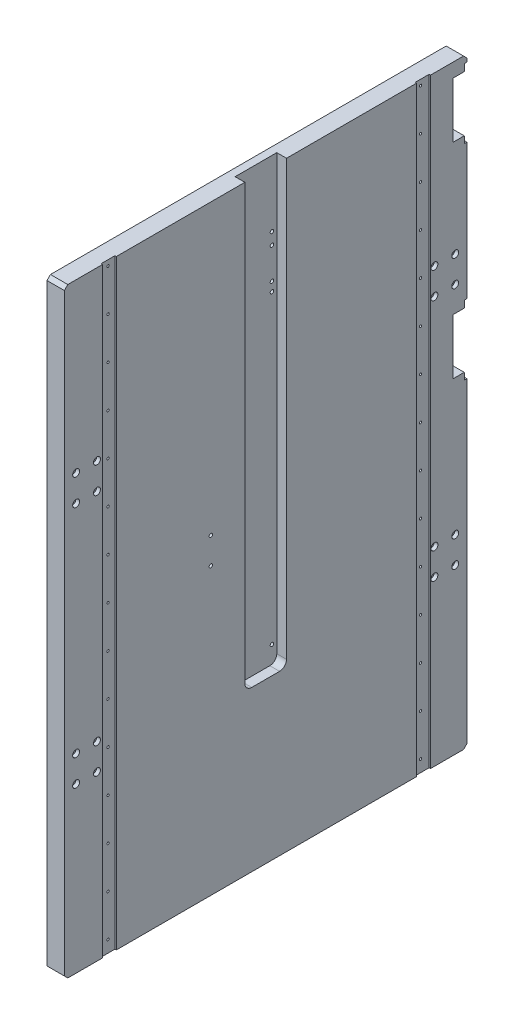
SolidWorks part; units mm, degrees
ref_plane "Plan1" through (0, 0, 0) normal (0, 0, 1) x (1, 0, 0)
ref_plane "Plan2" through (0, 0, 0) normal (0, 1, 0) x (1, 0, 0)
ref_plane "Plan3" through (0, 0, 0) normal (1, 0, 0) x (0, 0, -1)
sketch "Esquisse1" plane through (0, 0, 0) normal (1, 0, 0) x (0, 0, -1)
  line L0 (0, 989.0525) -> (0, -18.7031) construction
  line L1 (0, 13.75) -> (0, -13.75) construction
  line L4 (-290, 530) -> (-290, -335)
  line L5 (-290, -335) -> (290, -335)
  line L6 (290, 530) -> (290, -335)
  line L7 (13.75, 0) -> (-13.75, 0) construction
  line L15 (-290, 530) -> (290, 530)
  dimension "D2" = 580
  dimension "D3" = 335
  dimension "D4" = 530
extrude "Boss.-Extru.1" add sketch "Esquisse1" against normal blind 25
sketch "Esquisse2" plane through (0, 0, 0) normal (1, 0, 0) x (0, 0, -1)
  line L0 (0, 890.1135) -> (0, 354.2428) construction
  line L2 (-30, 530) -> (-30, -95)
  line L4 (30, 530) -> (30, -95)
  line L5 (0, 13.75) -> (0, -13.75) construction
  line L7 (290, 530) -> (-290, 530) construction
  line L12 (-20, -105) -> (20, -105)
  line L24 (-30, 530) -> (30, 530)
  arc A6 (30, -95) -> (20, -105) centre (20, -95) cw
  arc A7 (-20, -105) -> (-30, -95) centre (-20, -95) cw
  dimension "D3" = 635
  dimension "D2" = 10
  dimension "D1" = 60
extrude "Enlèv. mat.-Extru.1" cut sketch "Esquisse2" against normal blind 14
hole_wizard "Trou taraudé M61" positions "Esquisse3" profile "Esquisse4" tap size "M6" standard "ISO"
sketch "Esquisse3" plane through (-14, 0, 0) normal (1, 0, 0) x (0, 0, -1)
  line L0 (0, 558.3188) -> (0, 340.3466) construction
  line L2 (0, 13.75) -> (0, -13.75) construction
  line L7 (290, 530) -> (30, 530) construction
  point P0 (-23, 373)
  point P2 (-23, 360)
  point P13 (23, 360)
  point P14 (23, 373)
  point P21 (-23, 418)
  point P23 (-23, 435)
  point P28 (23, 435)
  point P29 (23, 418)
  point P32 (-23, -80)
  point P34 (23, -80)
  dimension "D1" = 46
  dimension "D2" = 13
  dimension "D3" = 170
  dimension "D4" = 58
  dimension "D5" = 17
  dimension "D6" = 440
sketch "Esquisse4" plane through (-14, 373, 23) normal (0, 1, 0) x (0, 0, -1)
  line L0 (0, 0) -> (0, 11)
  line L1 (0, 11) -> (2.5, 11)
  line L2 (2.5, 11) -> (2.5, 0)
  line L5 (2.5, 0) -> (0, 0)
  line L11 (0, -6.35) -> (0, 107.95) construction
  dimension "Diamètre du trou pour taraudage jusqu'au prochain" = 5
  dimension "Profondeur du trou pour taraudage jusqu'au prochain" = 11
sketch "Esquisse17" plane through (0, 0, 0) normal (-1, 0, 0) x (0, 0, 1)
  line L1 (-237.5, 530) -> (-217.5, 530)
  line L2 (-237.5, 530) -> (-237.5, -335)
  line L3 (-237.5, -335) -> (-217.5, -335)
  line L4 (-217.5, 530) -> (-217.5, -335)
  line L5 (215, 530) -> (235, 530)
  line L6 (215, 530) -> (215, -335)
  line L7 (215, -335) -> (235, -335)
  line L8 (235, 530) -> (235, -335)
  line L9 (290, -335) -> (-290, -335) construction
  line L10 (-225, -146.0818) -> (-225, 642.6306) construction
  line L11 (0, -13.75) -> (0, 13.75) construction
  line L12 (0, 662.781) -> (0, -107.936) construction
  line L13 (-290, 530) -> (-30, 530) construction
  line L14 (225, -75.7623) -> (225, 642.6306) construction
  line L15 (30, 530) -> (290, 530) construction
  dimension "D1" = 7.5
  dimension "D2" = 450
  dimension "D3" = 20
  dimension "D4" = 20
extrude "Enlèv. mat.-Extru.6" cut sketch "Esquisse17" along normal blind 2
hole_wizard "Chambrage pour vis à tête hexagonale M51" positions "Esquisse22" profile "Esquisse23" counterbore size "M5" standard "ISO"
sketch "Esquisse22" plane through (0, 0, 0) normal (1, 0, 0) x (0, 0, -1)
  line L0 (254.4012, 270) -> (-290.5094, 270) construction
  line L2 (258, 307.742) -> (258, 237.6102) construction
  line L4 (13.75, 0) -> (-13.75, 0) construction
  line L5 (0, 13.75) -> (0, -13.75) construction
  line L7 (290, 251) -> (273, 251)
  line L8 (273, 251) -> (243, 251)
  line L10 (-243, 251) -> (-273, 251)
  line L11 (-273, 251) -> (-290, 251)
  line L12 (-290, 530) -> (-290, -335) construction
  line L13 (290, -335) -> (290, 530) construction
  point P15 (273, 289)
  point P17 (273, 251)
  point P19 (243, 251)
  point P21 (243, 289)
  point P27 (-243, 251)
  point P29 (-273, 251)
  point P31 (-273, 289)
  point P33 (-243, 289)
  dimension "D1" = 270
  dimension "D2" = 258
  dimension "D3" = 38
  dimension "D4" = 30
  dimension "D6" = 516
sketch "Esquisse23" plane through (0, 289, 243) normal (0, 1, 0) x (0, 0, -1)
  line L0 (0, 0) -> (0, 25)
  line L1 (0, 25) -> (2.75, 25)
  line L3 (2.75, 25) -> (2.75, 5.4)
  line L4 (2.75, 5.4) -> (5, 5.4)
  line L5 (5, 5.4) -> (5, 0)
  line L7 (5, 0) -> (0, 0)
  line L11 (0, -6.35) -> (0, 107.95) construction
  dimension "Diamètre du perçage jusqu'au prochain" = 5.5
  dimension "Profondeur du perçage jusqu'au prochain" = 25
  dimension "Diamètre du chambrage" = 10
  dimension "Profondeur du chambrage" = 5.4
pattern_linear "Répétition linéaire1" count 2 spacing 350 along (0, -1, 0) of "Chambrage pour vis à tête hexagonale M51"
hole_wizard "Trou taraudé M44" positions "Esquisse26" profile "Esquisse27" tap size "M4" standard "ISO"
sketch "Esquisse26" plane through (-2, 0, 0) normal (1, 0, 0) x (0, 0, -1)
  line L0 (-225, -75.7623) -> (-225, 642.6306) construction
  line L1 (225, -146.0818) -> (225, 642.6306) construction
  line L2 (237.5, 530) -> (217.5, 530) construction
  point P0 (225, 522)
  point P2 (-225, 522)
  dimension "D1" = 8
sketch "Esquisse27" plane through (-2, 522, -225) normal (0, 1, 0) x (0, 0, -1)
  line L0 (0, 0) -> (0, 11.0914)
  line L1 (0, 11.0914) -> (1.65, 10.1)
  line L2 (1.65, 10.1) -> (1.65, 0)
  line L5 (1.65, 0) -> (0, 0)
  line L10 (0, 11.0914) -> (-1.65, 10.1) construction
  line L11 (0, -6.35) -> (0, 107.95) construction
  dimension "Diamètre du trou pour taraudage" = 3.3
  dimension "Profondeur du trou pour taraudage" = 10.1
  dimension "Angle de pointe" = 118
pattern_linear "Répétition linéaire2" count 15 spacing 60 along (0, -1, 0) of "Trou taraudé M44"
hole_wizard "Trou taraudé M62" positions "Esquisse30" profile "Esquisse31" tap size "M6" standard "ISO"
sketch "Esquisse30" plane through (-25, 0, 0) normal (-1, 0, 0) x (0, 0, 1)
  line L0 (-313.3363, 95) -> (312.2973, 95) construction
  line L2 (13.75, 0) -> (-13.75, 0) construction
  line L3 (0, -13.75) -> (0, 13.75) construction
  point P5 (21, 76)
  point P7 (79, 76)
  point P9 (79, 114)
  point P10 (21, 114)
  dimension "D1" = 95
  dimension "D2" = 58
  dimension "D3" = 38
  dimension "D4" = 79
sketch "Esquisse31" plane through (-25, 114, 21) normal (0, 1, 0) x (0, 0, 1)
  line L0 (0, 0) -> (0, 25)
  line L1 (0, 25) -> (2.5, 25)
  line L2 (2.5, 25) -> (2.5, 0)
  line L5 (2.5, 0) -> (0, 0)
  line L11 (0, -6.35) -> (0, 107.95) construction
  dimension "Diamètre du trou pour taraudage jusqu'au prochain" = 5
  dimension "Profondeur du trou pour taraudage jusqu'au prochain" = 25
sketch "Esquisse32" plane through (-25, 0, 0) normal (-1, 0, 0) x (0, 0, 1)
  line L0 (-290, -335) -> (-290, 530) construction
  line L1 (-286, 430) -> (-270, 430)
  line L2 (-290, 420) -> (-290, 520)
  line L3 (-286, 510) -> (-270, 510)
  line L4 (-270, 430) -> (-270, 510)
  line L5 (-290, 530) -> (290, 530) construction
  line L6 (-290, 420) -> (-286, 420)
  line L7 (-286, 420) -> (-286, 430)
  line L8 (-286, 520) -> (-290, 520)
  line L9 (-286, 510) -> (-286, 520)
  dimension "D4" = 4
  dimension "D1" = 20
  dimension "D2" = 20
  dimension "D3" = 80
  dimension "D5" = 10
extrude "Enlèv. mat.-Extru.7" cut sketch "Esquisse32" against normal blind 30
hole_wizard "Trou taraudé M31" positions "Esquisse33" profile "Esquisse34" tap size "M3" standard "ISO"
sketch "Esquisse33" plane through (0, 0, -270) normal (0, 0, -1) x (-1, 0, 0)
  line L0 (0, 430) -> (0, 510) construction
  line L1 (10, 492.5) -> (10, 487.5)
  line L2 (10, 487.5) -> (10, 482.5)
  line L4 (10, 457.5) -> (10, 452.5)
  line L5 (10, 452.5) -> (10, 447.5)
  line L8 (10, 492.5) -> (10, 497.5)
  line L12 (10, 447.5) -> (10, 442.5)
  line L16 (0, 510) -> (25, 510) construction
  line L17 (0, 430) -> (25, 430) construction
  line L18 (10, 497.5) -> (10, 510)
  line L19 (10, 442.5) -> (10, 430)
  point P0 (10, 492.5)
  point P2 (10, 457.5)
  point P11 (10, 487.5)
  point P13 (10, 482.5)
  point P17 (10, 452.5)
  point P60 (10, 497.5)
  point P63 (10, 442.5)
  point P67 (10, 447.5)
  dimension "D1" = 10
  dimension "D2" = 35
  dimension "D3" = 5
sketch "Esquisse34" plane through (-10, 492.5, -270) normal (1, 0, 0) x (0, 1, 0)
  line L0 (0, 0) -> (0, 8.2511)
  line L1 (0, 8.2511) -> (1.25, 7.5)
  line L2 (1.25, 7.5) -> (1.25, 0)
  line L5 (1.25, 0) -> (0, 0)
  line L10 (0, 8.2511) -> (-1.25, 7.5) construction
  line L11 (0, -6.35) -> (0, 107.95) construction
  dimension "Diamètre du trou pour taraudage" = 2.5
  dimension "Profondeur du trou pour taraudage" = 7.5
  dimension "Angle de pointe" = 118
hole_wizard "Trou taraudé M32" positions "Esquisse35" profile "Esquisse36" tap size "M3" standard "ISO"
sketch "Esquisse35" plane through (0, 0, -286) normal (0, 0, -1) x (-1, 0, 0)
  line L0 (0, 510) -> (0, 520) construction
  line L1 (12.5, 515) -> (12.5, 520)
  line L5 (12.5, 425) -> (12.5, 420)
  line L9 (25, 520) -> (0, 520) construction
  line L10 (0, 420) -> (25, 420) construction
  point P0 (12.5, 515)
  point P2 (12.5, 425)
  dimension "D1" = 90
  dimension "D2" = 12.5
sketch "Esquisse36" plane through (-12.5, 515, -286) normal (1, 0, 0) x (0, 1, 0)
  line L0 (0, 0) -> (0, 8.2511)
  line L1 (0, 8.2511) -> (1.25, 7.5)
  line L2 (1.25, 7.5) -> (1.25, 0)
  line L5 (1.25, 0) -> (0, 0)
  line L10 (0, 8.2511) -> (-1.25, 7.5) construction
  line L11 (0, -6.35) -> (0, 107.95) construction
  dimension "Diamètre du trou pour taraudage" = 2.5
  dimension "Profondeur du trou pour taraudage" = 7.5
  dimension "Angle de pointe" = 118
pattern_linear "Répétition linéaire3" count 2 spacing 295 along (0, -1, 0) of "Enlèv. mat.-Extru.7", "Trou taraudé M31", "Trou taraudé M32"
chamfer "Chanfrein1" distance 5 angle 45 4 edges at (-12.5, 530, -290) (-12.5, 530, 290) (-12.5, -335, 290) (-12.5, -335, -290)
